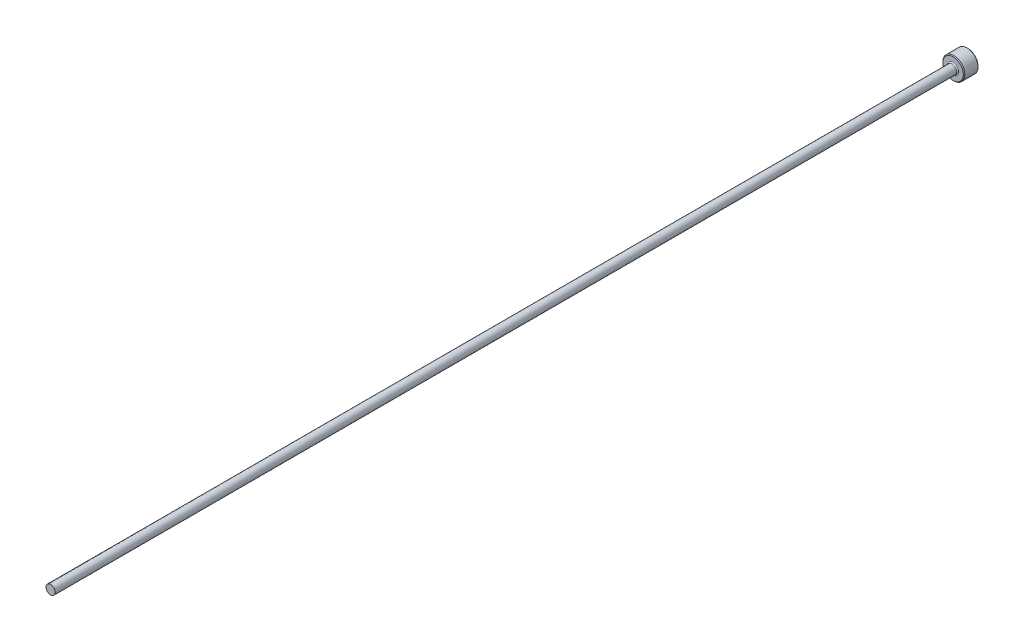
SolidWorks part; units mm, degrees
ref_plane "Front Plane" through (0, 0, 0) normal (0, 0, 1) x (1, 0, 0)
ref_plane "Top Plane" through (0, 0, 0) normal (0, 1, 0) x (1, 0, 0)
ref_plane "Right Plane" through (0, 0, 0) normal (1, 0, 0) x (0, 0, -1)
sketch "Sketch1" plane through (0, 0, 0) normal (1, 0, 0) x (0, 0, -1)
  line L0 (0, 0) -> (0, 3)
  line L1 (0, 3.3) -> (0, -3.3) construction
  line L2 (0, 3) -> (-4, 3)
  line L3 (-4, 3) -> (-4, 1.55)
  line L4 (-4.3, 1.25) -> (-250, 1.25)
  line L5 (-250, 1.25) -> (-250, 0)
  line L6 (3.3, 0) -> (-3.3, 0) construction
  line L7 (-250, 0) -> (0, 0)
  line L8 (-109.0506, 0) -> (16.9928, 0) construction
  arc A0 (-4, 1.55) -> (-4.3, 1.25) centre (-4.3, 1.55) cw
  dimension "D1" = 0.3
  dimension "D2" = 6
  dimension "D3" = 2.5
  dimension "D4" = 250
  dimension "D5" = 4
revolve "Revolve1" add sketch "Sketch1" angle 360 about L8
chamfer "Chamfer1" distance 0.2 angle 45 2 edges at (3, 0, 0) (3, 0, 4)
